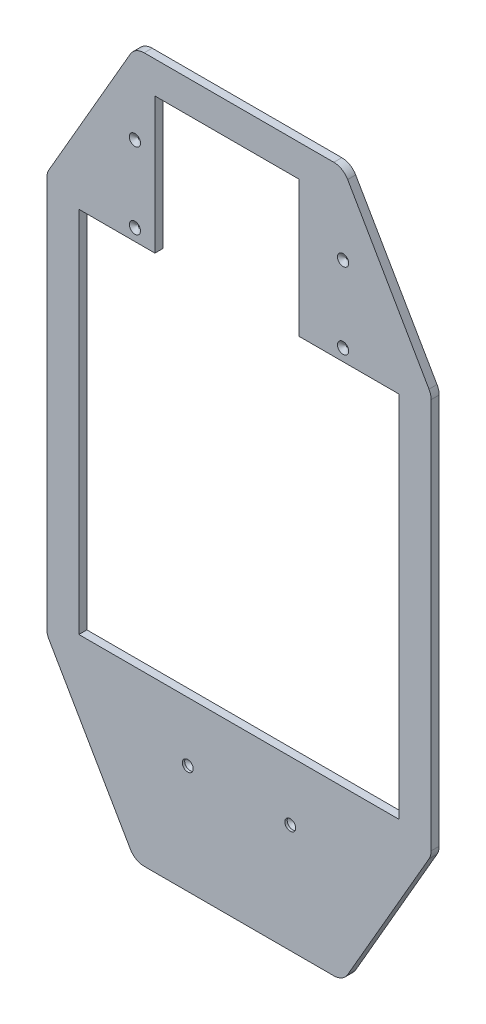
SolidWorks part; units mm, degrees
ref_plane "前视基准面" through (0, 0, 0) normal (0, 0, 1) x (1, 0, 0)
ref_plane "上视基准面" through (0, 0, 0) normal (0, 1, 0) x (1, 0, 0)
ref_plane "右视基准面" through (0, 0, 0) normal (1, 0, 0) x (0, 0, -1)
sketch "草图1" plane through (0, 0, 0) normal (0, 0, 1) x (1, 0, 0)
  line L0 (-98.6603, 121.6667) -> (-56.3212, 195)
  line L1 (47.661, 200) -> (-47.661, 200)
  line L2 (100, 116.6667) -> (100, -116.6667)
  line L3 (47.661, -200) -> (-47.661, -200)
  line L4 (-100, 116.6667) -> (-100, -116.6667)
  line L5 (-118.6603, 127.0257) -> (-67.8682, 215)
  line L6 (59.208, 220) -> (-59.208, 220)
  line L7 (0, 0) -> (0, 150) construction
  line L8 (0, 0) -> (100, 0) construction
  line L9 (98.6603, 121.6667) -> (56.3212, 195)
  line L10 (98.6603, -121.6667) -> (56.3212, -195)
  line L11 (-98.6603, -121.6667) -> (-56.3212, -195)
  line L12 (118.6603, 127.0257) -> (67.8682, 215)
  line L13 (120, 122.0257) -> (120, -122.0257)
  line L14 (118.6603, -127.0257) -> (67.8682, -215)
  line L15 (59.208, -220) -> (-59.208, -220)
  line L16 (-118.6603, -127.0257) -> (-67.8682, -215)
  line L17 (-120, 122.0257) -> (-120, -122.0257)
  line L18 (-120, -124.7051) -> (-64.9815, -220) construction
  line L19 (-120, 124.7051) -> (-120, -124.7051) construction
  line L20 (64.9815, -220) -> (-64.9815, -220) construction
  line L21 (120, -124.7051) -> (64.9815, -220) construction
  line L22 (120, 124.7051) -> (120, -124.7051) construction
  line L23 (-100, -119.3462) -> (-53.4345, -200) construction
  line L24 (53.4345, -200) -> (-53.4345, -200) construction
  line L25 (-100, 119.3462) -> (-100, -119.3462) construction
  line L26 (100, -119.3462) -> (53.4345, -200) construction
  line L27 (100, 119.3462) -> (100, -119.3462) construction
  line L28 (100, 119.3462) -> (53.4345, 200) construction
  line L29 (53.4345, 200) -> (-53.4345, 200) construction
  line L30 (-100, 119.3462) -> (-53.4345, 200) construction
  line L31 (120, 124.7051) -> (64.9815, 220) construction
  line L32 (64.9815, 220) -> (-64.9815, 220) construction
  line L33 (-120, 124.7051) -> (-64.9815, 220) construction
  arc A0 (-118.6603, -127.0257) -> (-120, -122.0257) centre (-110, -122.0257) cw
  arc A1 (-59.208, -220) -> (-67.8682, -215) centre (-59.208, -210) cw
  arc A2 (67.8682, -215) -> (59.208, -220) centre (59.208, -210) cw
  arc A3 (120, -122.0257) -> (118.6603, -127.0257) centre (110, -122.0257) cw
  arc A4 (-56.3212, -195) -> (-47.661, -200) centre (-47.661, -190) ccw
  arc A5 (-98.6603, -121.6667) -> (-100, -116.6667) centre (-90, -116.6667) cw
  arc A6 (56.3212, -195) -> (47.661, -200) centre (47.661, -190) cw
  arc A7 (98.6603, -121.6667) -> (100, -116.6667) centre (90, -116.6667) ccw
  arc A8 (56.3212, 195) -> (47.661, 200) centre (47.661, 190) ccw
  arc A9 (98.6603, 121.6667) -> (100, 116.6667) centre (90, 116.6667) cw
  arc A10 (-56.3212, 195) -> (-47.661, 200) centre (-47.661, 190) cw
  arc A11 (-98.6603, 121.6667) -> (-100, 116.6667) centre (-90, 116.6667) ccw
  arc A12 (118.6603, 127.0257) -> (120, 122.0257) centre (110, 122.0257) cw
  arc A13 (59.208, 220) -> (67.8682, 215) centre (59.208, 210) cw
  arc A14 (-67.8682, 215) -> (-59.208, 220) centre (-59.208, 210) cw
  arc A15 (-118.6603, 127.0257) -> (-120, 122.0257) centre (-110, 122.0257) ccw
  point P0 (0, 0)
  point P37 (-53.4345, -200)
  point P50 (53.4345, 200)
  dimension "D6" = 10
  dimension "D7" = 73.3333
  dimension "D1" = 400
  dimension "D2" = 200
  dimension "D3" = 100
  dimension "D4" = 200
  dimension "D5" = 20
  dimension "D8" = 30
  dimension "D9" = 73.3333
  dimension "D10" = 30
extrude "凸台-拉伸1" add sketch "草图1" along normal blind 30
sketch "草图2" plane through (0, 0, 30) normal (0, 0, 1) x (1, 0, 0)
  line L0 (-100, 130) -> (-70, 130)
  line L1 (-100, 116.6667) -> (-100, -116.6667) construction
  line L2 (-70, 130) -> (-70, 200)
  line L3 (47.661, 200) -> (-47.661, 200) construction
  line L4 (-70, 200) -> (-37.5, 200)
  line L5 (-37.5, 200) -> (-37.5, 115)
  line L6 (-37.5, 115) -> (-100, 115)
  line L7 (-100, 115) -> (-100, 130)
  line L8 (0, 0) -> (0, 200) construction
  dimension "D1" = 15
  dimension "D2" = 32.5
  dimension "D3" = 37.5
  dimension "D4" = 115
extrude "凸台-拉伸2" add sketch "草图2" against normal blind 40
mirror "镜向1" about plane through (0, 0, 0) normal (0, 1, 0) of "凸台-拉伸2"
mirror "镜向2" about plane through (0, 0, 0) normal (1, 0, 0) of "凸台-拉伸2", "镜向1"
sketch "草图3" plane through (0, 0, 0) normal (0, 0, -1) x (-1, 0, 0)
  line L0 (-100, 115) -> (100, 115)
  line L1 (100, 115) -> (100, -115)
  line L2 (100, -115) -> (-100, -115)
  line L3 (-100, -115) -> (-100, 115)
  line L8 (120, -122.0257) -> (120, 122.0257)
  line L10 (120, -122.0257) -> (120, 122.0257)
  line L12 (-120, 122.0257) -> (-120, -122.0257)
  line L13 (-118.6603, -127.0257) -> (-67.8682, -215)
  line L14 (118.6603, 127.0257) -> (67.8682, 215)
  line L20 (-120, 122.0257) -> (-120, -122.0257)
  line L21 (-118.6603, -127.0257) -> (-67.8682, -215)
  line L28 (118.6603, 127.0257) -> (67.8682, 215)
  line L29 (59.208, 220) -> (-59.208, 220)
  line L30 (59.208, 220) -> (-59.208, 220)
  line L31 (-67.8682, 215) -> (-118.6603, 127.0257)
  line L32 (-67.8682, 215) -> (-118.6603, 127.0257)
  line L34 (-59.208, -220) -> (59.208, -220)
  line L36 (-59.208, -220) -> (59.208, -220)
  line L38 (67.8682, -215) -> (118.6603, -127.0257)
  line L40 (67.8682, -215) -> (118.6603, -127.0257)
  arc A8 (118.6603, -127.0257) -> (120, -122.0257) centre (110, -122.0257) ccw
  arc A9 (118.6603, -127.0257) -> (120, -122.0257) centre (110, -122.0257) ccw
  arc A10 (120, 122.0257) -> (118.6603, 127.0257) centre (110, 122.0257) ccw
  arc A11 (120, 122.0257) -> (118.6603, 127.0257) centre (110, 122.0257) ccw
  arc A12 (-118.6603, 127.0257) -> (-120, 122.0257) centre (-110, 122.0257) ccw
  arc A13 (-120, -122.0257) -> (-118.6603, -127.0257) centre (-110, -122.0257) ccw
  arc A14 (67.8682, 215) -> (59.208, 220) centre (59.208, 210) ccw
  arc A15 (67.8682, 215) -> (59.208, 220) centre (59.208, 210) ccw
  arc A20 (-118.6603, 127.0257) -> (-120, 122.0257) centre (-110, 122.0257) ccw
  arc A21 (-120, -122.0257) -> (-118.6603, -127.0257) centre (-110, -122.0257) ccw
  arc A24 (-59.208, 220) -> (-67.8682, 215) centre (-59.208, 210) ccw
  arc A25 (-59.208, 220) -> (-67.8682, 215) centre (-59.208, 210) ccw
  arc A26 (-67.8682, -215) -> (-59.208, -220) centre (-59.208, -210) ccw
  arc A27 (-67.8682, -215) -> (-59.208, -220) centre (-59.208, -210) ccw
  arc A28 (59.208, -220) -> (67.8682, -215) centre (59.208, -210) ccw
  arc A29 (59.208, -220) -> (67.8682, -215) centre (59.208, -210) ccw
  dimension "D1" = 0
extrude "凸台-拉伸3" add sketch "草图3" along normal blind 20
sketch "草图5" plane through (0, 0, -20) normal (0, 0, -1) x (-1, 0, 0)
  line L0 (-67.8682, 215) -> (-67.8682, 310)
  line L1 (-67.8682, 310) -> (67.8682, 310)
  line L2 (67.8682, 310) -> (67.8682, 215)
  line L3 (59.208, 220) -> (-59.208, 220) construction
  line L4 (59.208, 220) -> (-59.208, 220)
  arc A0 (67.8682, 215) -> (59.208, 220) centre (59.208, 210) ccw construction
  arc A1 (-59.208, 220) -> (-67.8682, 215) centre (-59.208, 210) ccw construction
  arc A2 (67.8682, 215) -> (59.208, 220) centre (59.208, 210) ccw
  arc A3 (-59.208, 220) -> (-67.8682, 215) centre (-59.208, 210) ccw
  dimension "D1" = 90
extrude "凸台-拉伸11" add sketch "草图5" against normal blind 15 from offset 10
fillet "圆角3" radius 5 2 edges at (67.8682, 310, -2.5) (-67.8682, 310, -2.5)
sketch "草图6" plane through (0, 0, 0) normal (1, 0, 0) x (0, 0, -1)
  line L0 (-30, 220) -> (-5, 220) construction
  line L1 (17, 221) -> (-5, 221)
  line L2 (17, 221) -> (17, 199)
  line L3 (17, 199) -> (-5, 199)
  line L4 (-5, 221) -> (-5, 199)
  line L5 (17, 221) -> (-5, 199) construction
  line L6 (17, 199) -> (-5, 221) construction
  line L7 (-30, 127.0257) -> (-30, 215) construction
  point P0 (6, 210)
  dimension "D1" = 22
  dimension "D2" = 10
  dimension "D3" = 22
  dimension "D4" = 25
extrude "凸台-拉伸12" add sketch "草图6" along normal mid plane 450
sketch "草图10" plane through (0, 0, 30) normal (0, 0, 1) x (1, 0, 0)
  line L0 (-65, 122.5) -> (-65, 170) construction
  line L2 (-100, 115) -> (-37.5, 115) construction
  dimension "D1" = 65
  dimension "D2" = 7.5
  dimension "D3" = 47.5
hole_wizard "M8x1.0 螺纹孔1" positions "3D草图1" profile "草图11" tap size "M8x1.0" standard "GB"
sketch3d "3D草图1"
  point P0 (-65, 122.5, 30)
  point P3 (-65, 170, 30)
sketch "草图11" plane through (-65, 122.5, 30) normal (1, 0, 0) x (0, -1, 0)
  line L0 (0, 0) -> (0, 23.103)
  line L1 (0, 23.103) -> (3.5, 21)
  line L2 (3.5, 21) -> (3.5, 0)
  line L5 (3.5, 0) -> (0, 0)
  line L10 (0, 23.103) -> (-3.5, 21) construction
  line L11 (0, -6.35) -> (0, 107.95) construction
  dimension "螺纹孔钻头直径" = 7
  dimension "螺纹孔钻头深度" = 21
  dimension "导头角度" = 118
mirror "镜向7" about plane through (0, 0, 0) normal (1, 0, 0) of "M8x1.0 螺纹孔1"
sketch "草图14" plane through (0, 0, 0) normal (0, 0, 1) x (1, 0, 0)
  line L0 (-37.5, 200) -> (37.5, 200)
  line L1 (37.5, 200) -> (37.5, 199)
  line L2 (37.5, 199) -> (-37.5, 199)
  line L3 (-37.5, 199) -> (-37.5, 200)
extrude "切除-拉伸1" cut sketch "草图14" along normal blind 10
mirror "镜向8" about plane through (0, 0, 0) normal (0, 1, 0) of "切除-拉伸1", "凸台-拉伸12", "凸台-拉伸11"
sketch "草图15" plane through (0, 0, 5) normal (0, 0, 1) x (1, 0, 0)
  line L0 (225, 210) -> (191, 210) construction
  line L1 (194, 213) -> (188, 213)
  line L2 (194, 213) -> (194, 207)
  line L3 (194, 207) -> (188, 207)
  line L4 (188, 213) -> (188, 207)
  line L5 (194, 213) -> (188, 207) construction
  line L6 (194, 207) -> (188, 213) construction
  line L7 (225, 221) -> (225, 199) construction
  line L8 (191, 210) -> (176, 210) construction
  line L10 (179, 213) -> (173, 213)
  line L11 (179, 213) -> (179, 207)
  line L12 (179, 207) -> (173, 207)
  line L13 (173, 213) -> (173, 207)
  line L14 (179, 213) -> (173, 207) construction
  line L15 (179, 207) -> (173, 213) construction
  point P0 (191, 210)
  dimension "D1" = 6
  dimension "D2" = 6
  dimension "D3" = 34
  dimension "D4" = 15
  dimension "D5" = 6
  dimension "D6" = 6
sketch "草图16" plane through (0, 0, 5) normal (0, 0, 1) x (1, 0, 0)
  line L0 (135, 199) -> (135, -199)
  line L1 (225, 199) -> (77.1058, 199) construction
  line L2 (225, -199) -> (77.1058, -199) construction
  line L3 (135, -199) -> (77.1058, -199)
  line L4 (77.1058, -199) -> (118.6603, -127.0257)
  line L5 (120, -122.0257) -> (120, 122.0257) construction
  line L6 (120, -122.0257) -> (120, 122.0257)
  line L7 (118.6603, 127.0257) -> (67.8682, 215) construction
  line L8 (118.6603, 127.0257) -> (77.1058, 199)
  line L9 (135, 199) -> (77.1058, 199)
  line L10 (0, 0) -> (0, -200) construction
  line L11 (-37.5, -200) -> (37.5, -200) construction
  line L12 (-135, 199) -> (-77.1058, 199)
  line L13 (-118.6603, 127.0257) -> (-77.1058, 199)
  line L14 (-120, -122.0257) -> (-120, 122.0257)
  line L15 (-77.1058, -199) -> (-118.6603, -127.0257)
  line L16 (-135, -199) -> (-77.1058, -199)
  line L17 (-135, 199) -> (-135, -199)
  arc A0 (118.6603, -127.0257) -> (120, -122.0257) centre (110, -122.0257) ccw construction
  arc A1 (118.6603, -127.0257) -> (120, -122.0257) centre (110, -122.0257) ccw
  arc A2 (120, 122.0257) -> (118.6603, 127.0257) centre (110, 122.0257) ccw construction
  arc A3 (120, 122.0257) -> (118.6603, 127.0257) centre (110, 122.0257) ccw
  arc A4 (-120, 122.0257) -> (-118.6603, 127.0257) centre (-110, 122.0257) cw
  arc A5 (-118.6603, -127.0257) -> (-120, -122.0257) centre (-110, -122.0257) cw
  dimension "D1" = 15
extrude "凸台-拉伸13" add sketch "草图16" against normal blind 20 from offset 1
sketch "草图17" plane through (0, 0, 4) normal (0, 0, 1) x (1, 0, 0)
  line L0 (105.9734, 199) -> (135, 148.7244)
  line L1 (135, 199) -> (77.1058, 199) construction
  line L2 (135, -199) -> (135, 199) construction
  line L3 (135, 148.7244) -> (135, 199)
  line L4 (225, 199) -> (77.1058, 199) construction
  line L5 (135, 199) -> (105.9734, 199)
  line L6 (77.1058, 199) -> (118.6603, 127.0257) construction
  line L7 (118.6603, 127.0257) -> (67.8682, 215) construction
  line L8 (0, 0) -> (308.3014, 0) construction
  line L9 (135, -199) -> (105.9734, -199)
  line L10 (135, -148.7244) -> (135, -199)
  line L11 (105.9734, -199) -> (135, -148.7244)
  line L12 (0, 0) -> (0, -200) construction
  line L13 (-37.5, -200) -> (37.5, -200) construction
  line L14 (-105.9734, -199) -> (-135, -148.7244)
  line L15 (-135, -148.7244) -> (-135, -199)
  line L16 (-135, -199) -> (-105.9734, -199)
  line L17 (-135, 199) -> (-105.9734, 199)
  line L18 (-135, 148.7244) -> (-135, 199)
  line L19 (-105.9734, 199) -> (-135, 148.7244)
  dimension "D1" = 25
extrude "切除-拉伸3" cut sketch "草图17" against normal blind 20
fillet "圆角4" radius 5 8 edges at (105.9734, -199, -6) (135, -148.7244, -6) (135, 148.7244, -6) (105.9734, 199, -6) (-105.9734, 199, -6) (-135, 148.7244, -6) (-135, -148.7244, -6) (-105.9734, -199, -6)
sketch "草图18" plane through (225, 0, 0) normal (1, 0, 0) x (0, 0, -1)
  line L0 (-5, 199) -> (17, 199) construction
  line L1 (8, 203) -> (4, 203)
  line L2 (8, 203) -> (8, 195)
  line L3 (8, 195) -> (4, 195)
  line L4 (4, 203) -> (4, 195)
  line L5 (8, 203) -> (4, 195) construction
  line L6 (8, 195) -> (4, 203) construction
  point P0 (6, 199)
  dimension "D1" = 8
  dimension "D2" = 4
sketch "草图19" plane through (0, 0, 30) normal (0, 0, 1) x (1, 0, 0)
  line L3 (-93.849, 130) -> (-70, 130)
  line L4 (-70, 130) -> (-70, 171.3077)
  line L5 (-70, 171.3077) -> (-93.849, 130)
  line L6 (-93.849, 130) -> (-70, 130)
  line L7 (-70, 130) -> (-70, 171.3077)
  line L8 (-70, 171.3077) -> (-93.849, 130)
  line L9 (93.849, 130) -> (70, 171.3077)
  line L10 (70, 171.3077) -> (70, 130)
  line L11 (70, 130) -> (93.849, 130)
  line L12 (93.849, 130) -> (70, 171.3077)
  line L13 (70, 171.3077) -> (70, 130)
  line L14 (70, 130) -> (93.849, 130)
  line L15 (93.849, -130) -> (70, -130)
  line L16 (70, -130) -> (70, -171.3077)
  line L17 (70, -171.3077) -> (93.849, -130)
  line L18 (93.849, -130) -> (70, -130)
  line L19 (70, -130) -> (70, -171.3077)
  line L20 (70, -171.3077) -> (93.849, -130)
  line L21 (-93.849, -130) -> (-70, -171.3077)
  line L22 (-70, -171.3077) -> (-70, -130)
  line L23 (-70, -130) -> (-93.849, -130)
  line L24 (-93.849, -130) -> (-70, -171.3077)
  line L25 (-70, -171.3077) -> (-70, -130)
  line L26 (-70, -130) -> (-93.849, -130)
  dimension "D1" = 0
  dimension "D2" = 0
  dimension "D3" = 0
  dimension "D4" = 0
extrude "凸台-拉伸14" add sketch "草图19" against normal up to next
sketch "草图20" plane through (0, 0, -20) normal (0, 0, -1) x (-1, 0, 0)
  line L1 (-100, 115) -> (100, 115)
  line L2 (-100, 115) -> (-100, -115)
  line L3 (-100, -115) -> (100, -115)
  line L4 (100, 115) -> (100, -115)
  line L8 (120, -122.0257) -> (120, 122.0257)
  line L9 (118.6603, 127.0257) -> (67.8682, 215)
  line L10 (59.208, 220) -> (-59.208, 220)
  line L11 (-67.8682, 215) -> (-118.6603, 127.0257)
  line L12 (-120, 122.0257) -> (-120, -122.0257)
  line L13 (-118.6603, -127.0257) -> (-67.8682, -215)
  line L14 (-59.208, -220) -> (59.208, -220)
  line L15 (67.8682, -215) -> (118.6603, -127.0257)
  line L16 (120, -122.0257) -> (120, 122.0257)
  line L17 (118.6603, 127.0257) -> (67.8682, 215)
  line L18 (59.208, 220) -> (-59.208, 220)
  line L19 (-67.8682, 215) -> (-118.6603, 127.0257)
  line L20 (-120, 122.0257) -> (-120, -122.0257)
  line L21 (-118.6603, -127.0257) -> (-67.8682, -215)
  line L22 (-59.208, -220) -> (59.208, -220)
  line L23 (67.8682, -215) -> (118.6603, -127.0257)
  arc A8 (118.6603, -127.0257) -> (120, -122.0257) centre (110, -122.0257) ccw
  arc A9 (120, 122.0257) -> (118.6603, 127.0257) centre (110, 122.0257) ccw
  arc A10 (67.8682, 215) -> (59.208, 220) centre (59.208, 210) ccw
  arc A11 (-59.208, 220) -> (-67.8682, 215) centre (-59.208, 210) ccw
  arc A12 (-118.6603, 127.0257) -> (-120, 122.0257) centre (-110, 122.0257) ccw
  arc A13 (-120, -122.0257) -> (-118.6603, -127.0257) centre (-110, -122.0257) ccw
  arc A14 (-67.8682, -215) -> (-59.208, -220) centre (-59.208, -210) ccw
  arc A15 (59.208, -220) -> (67.8682, -215) centre (59.208, -210) ccw
  arc A16 (118.6603, -127.0257) -> (120, -122.0257) centre (110, -122.0257) ccw
  arc A17 (120, 122.0257) -> (118.6603, 127.0257) centre (110, 122.0257) ccw
  arc A18 (67.8682, 215) -> (59.208, 220) centre (59.208, 210) ccw
  arc A19 (-59.208, 220) -> (-67.8682, 215) centre (-59.208, 210) ccw
  arc A20 (-118.6603, 127.0257) -> (-120, 122.0257) centre (-110, 122.0257) ccw
  arc A21 (-120, -122.0257) -> (-118.6603, -127.0257) centre (-110, -122.0257) ccw
  arc A22 (-67.8682, -215) -> (-59.208, -220) centre (-59.208, -210) ccw
  arc A23 (59.208, -220) -> (67.8682, -215) centre (59.208, -210) ccw
  dimension "D1" = 0
extrude "凸台-拉伸15" add sketch "草图20" along normal blind 5
sketch "草图22" plane through (67.8682, 0, 0) normal (1, 0, 0) x (0, 0, -1)
  line L0 (10, 305) -> (10, 221) construction
  line L1 (10, 262) -> (0, 262)
  line L2 (10, 262) -> (10, 290)
  line L3 (10, 290) -> (0, 290)
  line L4 (0, 262) -> (0, 290)
  line L5 (-5, 310) -> (10, 310) construction
  line L6 (0, 264) -> (10, 266)
  line L7 (10, 272) -> (0, 274)
  line L8 (0, 276) -> (10, 276) construction
  line L9 (10, 280) -> (0, 278)
  line L10 (0, 288) -> (10, 286)
  dimension "D1" = 10
  dimension "D2" = 28
  dimension "D3" = 20
  dimension "D4" = 4
  dimension "D5" = 4
  dimension "D6" = 2
  dimension "D7" = 10
sketch "草图24" plane through (0, 0, 0) normal (0, 0, 1) x (1, 0, 0)
  line L4 (-37.5, -115) -> (-37.5, -200)
  line L7 (37.5, -115) -> (-37.5, -115)
  line L11 (37.5, -115) -> (-37.5, -115)
  line L16 (-37.5, -115) -> (-37.5, -200)
  line L19 (-37.5, -200) -> (37.5, -200)
  line L21 (-37.5, -200) -> (37.5, -200)
  line L22 (37.5, -200) -> (37.5, -115)
  line L23 (37.5, -200) -> (37.5, -115)
  dimension "D1" = 0
extrude "凸台-拉伸16" add sketch "草图24" along normal up to surface (30 mm away)
sketch "草图25" plane through (0, -115, 0) normal (0, 1, 0) x (1, 0, 0)
  line L0 (0, -30) -> (0, 22) construction
  line L1 (-100, -30) -> (100, -30) construction
  dimension "D1" = 52
hole_wizard "M8 螺纹孔1" positions "3D草图2" profile "草图26" tap size "M8" standard "GB"
sketch3d "3D草图2"
  point P0 (0, -115, -22)
sketch "草图26" plane through (0, -115, -22) normal (1, 0, 0) x (0, 0, 1)
  line L0 (0, 0) -> (0, 22.0429)
  line L1 (0, 22.0429) -> (3.4, 20)
  line L2 (3.4, 20) -> (3.4, 0)
  line L5 (3.4, 0) -> (0, 0)
  line L10 (0, 22.0429) -> (-3.4, 20) construction
  line L11 (0, -6.35) -> (0, 107.95) construction
  dimension "螺纹孔钻头直径" = 6.8
  dimension "螺纹孔钻头深度" = 20
  dimension "导头角度" = 118
sketch "草图27" plane through (0, 0, 30) normal (0, 0, 1) x (1, 0, 0)
  line L0 (-16, -115) -> (-16, -105)
  line L1 (-100, -115) -> (100, -115) construction
  line L2 (-16, -105) -> (16, -105)
  line L3 (0, -105) -> (0, -111) construction
  line L4 (12, -111) -> (-12, -111)
  line L5 (-12, -111) -> (-12, -115)
  line L6 (-12, -115) -> (-16, -115)
  line L7 (0, 0) -> (0, -105) construction
  line L8 (12, -115) -> (16, -115)
  line L9 (12, -111) -> (12, -115)
  line L10 (16, -115) -> (16, -105)
  dimension "D1" = 6
  dimension "D2" = 10
  dimension "D3" = 12
  dimension "D4" = 16
extrude "凸台-拉伸17" add sketch "草图27" against normal blind 5 from offset 12
pattern_linear "阵列(线性)2" count 2 spacing 26 along (0, 0, -1) of "凸台-拉伸17"
sketch "草图28" plane through (0, 0, 30) normal (0, 0, 1) x (1, 0, 0)
  line L0 (0, -115) -> (0, -152) construction
  line L1 (-100, -115) -> (100, -115) construction
  line L2 (0, -152) -> (-32, -152) construction
  line L3 (0, -152) -> (32, -152) construction
  dimension "D1" = 37
  dimension "D2" = 32
  dimension "D3" = 32
hole_wizard "M8 螺纹孔2" positions "3D草图3" profile "草图29" tap size "M8" standard "GB"
sketch3d "3D草图3"
  point P0 (-32, -152, 30)
  point P3 (32, -152, 30)
sketch "草图29" plane through (-32, -152, 30) normal (1, 0, 0) x (0, -1, 0)
  line L0 (0, 0) -> (0, 24.5429)
  line L1 (0, 24.5429) -> (3.4, 22.5)
  line L2 (3.4, 22.5) -> (3.4, 0)
  line L5 (3.4, 0) -> (0, 0)
  line L10 (0, 24.5429) -> (-3.4, 22.5) construction
  line L11 (0, -6.35) -> (0, 107.95) construction
  dimension "螺纹孔钻头直径" = 6.8
  dimension "螺纹孔钻头深度" = 22.5
  dimension "导头角度" = 118
sketch "草图30" plane through (-67.8682, 0, 0) normal (-1, 0, 0) x (0, 0, 1)
  line L0 (-10, -310) -> (-38.263, -300.579)
  line L1 (-57.2367, -297.5) -> (-125, -297.5)
  line L2 (-127.5, -295) -> (-127.5, -290)
  line L3 (-125, -287.5) -> (-10, -287.5)
  line L4 (-10, -221) -> (-10, -310) construction
  line L5 (-10, -287.5) -> (-10, -310)
  arc A0 (-38.263, -300.579) -> (-57.2367, -297.5) centre (-57.2367, -357.5) ccw
  arc A1 (-127.5, -290) -> (-125, -287.5) centre (-125, -290) cw
  arc A2 (-125, -297.5) -> (-127.5, -295) centre (-125, -295) cw
  point P10 (-47.5, -297.5)
  point P13 (-127.5, -287.5)
  point P16 (-127.5, -297.5)
  dimension "D5" = 60
  dimension "D6" = 2.5
  dimension "D1" = 12.5
  dimension "D2" = 10
  dimension "D3" = 117.5
  dimension "D4" = 80
sketch "草图32" plane through (0, 0, 30) normal (0, 0, 1) x (1, 0, 0)
  line L0 (-37.5, 200) -> (-52.5, 200)
  line L1 (-52.5, 200) -> (-52.5, 115)
  line L2 (-100, 115) -> (-37.5, 115) construction
  line L3 (-52.5, 115) -> (-37.5, 115)
  line L4 (-37.5, 115) -> (-37.5, 200)
  dimension "D1" = 15
extrude "切除-拉伸7" cut sketch "草图32" against normal up to surface (30 mm away)
sketch "草图33" plane through (0, 0, 0) normal (0, 0, 1) x (1, 0, 0)
  line L4 (37.5, 115) -> (37.5, 200)
  line L6 (-52.5, 200) -> (-52.5, 115)
  line L7 (-52.5, 115) -> (37.5, 115)
  line L10 (-52.5, 200) -> (-52.5, 115)
  line L11 (-52.5, 115) -> (37.5, 115)
  line L12 (37.5, 115) -> (37.5, 200)
  line L14 (37.5, 200) -> (-52.5, 200)
  line L15 (37.5, 200) -> (-52.5, 200)
  dimension "D1" = 0
extrude "切除-拉伸8" cut sketch "草图33" against normal blind 12
sketch "草图34" plane through (0, 0, 30) normal (0, 0, 1) x (1, 0, 0)
  line L0 (-100, -115) -> (100, -115) construction
  line L1 (-50, -115) -> (50, -115)
  line L2 (-50, -115) -> (-50, -174)
  line L3 (-50, -174) -> (50, -174)
  line L4 (50, -115) -> (50, -174)
  line L5 (0, -174) -> (0, -220) construction
  line L6 (59.208, -220) -> (-59.208, -220) construction
  dimension "D1" = 100
  dimension "D2" = 59
extrude "切除-拉伸9" cut sketch "草图34" against normal blind 9.25
sketch "草图35" plane through (0, 0, 30) normal (0, 0, 1) x (1, 0, 0)
  line L2 (-175.1264, 290.7759) -> (175.1264, 290.7759)
  line L3 (-175.1264, 290.7759) -> (-175.1264, -290.7759)
  line L4 (-175.1264, -290.7759) -> (175.1264, -290.7759)
  line L5 (175.1264, 290.7759) -> (175.1264, -290.7759)
  line L6 (-175.1264, 290.7759) -> (175.1264, -290.7759) construction
  line L7 (-175.1264, -290.7759) -> (175.1264, 290.7759) construction
  point P2 (0, 0)
extrude "切除-拉伸10" cut sketch "草图35" against normal offset from surface (21 mm away) 5
sketch "草图40" plane through (0, 0, -25) normal (0, 0, -1) x (-1, 0, 0)
  line L1 (-294.8809, 339.2041) -> (294.8809, 339.2041)
  line L2 (-294.8809, 339.2041) -> (-294.8809, -339.2041)
  line L3 (-294.8809, -339.2041) -> (294.8809, -339.2041)
  line L4 (294.8809, 339.2041) -> (294.8809, -339.2041)
  line L5 (-294.8809, 339.2041) -> (294.8809, -339.2041) construction
  line L6 (-294.8809, -339.2041) -> (294.8809, 339.2041) construction
  point P0 (0, 0)
sketch "草图42" plane through (0, 0, -25) normal (0, 0, -1) x (-1, 0, 0)
  line L8 (120, -122.0257) -> (120, 122.0257)
  line L9 (118.6603, 127.0257) -> (67.8682, 215)
  line L10 (59.208, 220) -> (-59.208, 220)
  line L11 (-67.8682, 215) -> (-118.6603, 127.0257)
  line L12 (-120, 122.0257) -> (-120, -122.0257)
  line L13 (-118.6603, -127.0257) -> (-67.8682, -215)
  line L14 (-59.208, -220) -> (59.208, -220)
  line L15 (67.8682, -215) -> (118.6603, -127.0257)
  line L16 (120, -122.0257) -> (120, 122.0257)
  line L17 (118.6603, 127.0257) -> (67.8682, 215)
  line L18 (59.208, 220) -> (-59.208, 220)
  line L19 (-67.8682, 215) -> (-118.6603, 127.0257)
  line L20 (-120, 122.0257) -> (-120, -122.0257)
  line L21 (-118.6603, -127.0257) -> (-67.8682, -215)
  line L22 (-59.208, -220) -> (59.208, -220)
  line L23 (67.8682, -215) -> (118.6603, -127.0257)
  arc A8 (118.6603, -127.0257) -> (120, -122.0257) centre (110, -122.0257) ccw
  arc A9 (120, 122.0257) -> (118.6603, 127.0257) centre (110, 122.0257) ccw
  arc A10 (67.8682, 215) -> (59.208, 220) centre (59.208, 210) ccw
  arc A11 (-59.208, 220) -> (-67.8682, 215) centre (-59.208, 210) ccw
  arc A12 (-118.6603, 127.0257) -> (-120, 122.0257) centre (-110, 122.0257) ccw
  arc A13 (-120, -122.0257) -> (-118.6603, -127.0257) centre (-110, -122.0257) ccw
  arc A14 (-67.8682, -215) -> (-59.208, -220) centre (-59.208, -210) ccw
  arc A15 (59.208, -220) -> (67.8682, -215) centre (59.208, -210) ccw
  arc A16 (118.6603, -127.0257) -> (120, -122.0257) centre (110, -122.0257) ccw
  arc A17 (120, 122.0257) -> (118.6603, 127.0257) centre (110, 122.0257) ccw
  arc A18 (67.8682, 215) -> (59.208, 220) centre (59.208, 210) ccw
  arc A19 (-59.208, 220) -> (-67.8682, 215) centre (-59.208, 210) ccw
  arc A20 (-118.6603, 127.0257) -> (-120, 122.0257) centre (-110, 122.0257) ccw
  arc A21 (-120, -122.0257) -> (-118.6603, -127.0257) centre (-110, -122.0257) ccw
  arc A22 (-67.8682, -215) -> (-59.208, -220) centre (-59.208, -210) ccw
  arc A23 (59.208, -220) -> (67.8682, -215) centre (59.208, -210) ccw
  dimension "D1" = 0
sketch "草图43" plane through (0, 0, -25) normal (0, 0, -1) x (-1, 0, 0)
  line L1 (-227.3114, 369.6277) -> (227.3114, 369.6277)
  line L2 (-227.3114, 369.6277) -> (-227.3114, -369.6277)
  line L3 (-227.3114, -369.6277) -> (227.3114, -369.6277)
  line L4 (227.3114, 369.6277) -> (227.3114, -369.6277)
  line L5 (-227.3114, 369.6277) -> (227.3114, -369.6277) construction
  line L6 (-227.3114, -369.6277) -> (227.3114, 369.6277) construction
  line L8 (120, -122.0257) -> (120, 122.0257)
  line L9 (118.6603, 127.0257) -> (67.8682, 215)
  line L10 (59.208, 220) -> (-59.208, 220)
  line L11 (-67.8682, 215) -> (-118.6603, 127.0257)
  line L12 (-120, 122.0257) -> (-120, -122.0257)
  line L13 (-118.6603, -127.0257) -> (-67.8682, -215)
  line L14 (-59.208, -220) -> (59.208, -220)
  line L15 (67.8682, -215) -> (118.6603, -127.0257)
  line L16 (120, -122.0257) -> (120, 122.0257)
  line L17 (118.6603, 127.0257) -> (67.8682, 215)
  line L18 (59.208, 220) -> (-59.208, 220)
  line L19 (-67.8682, 215) -> (-118.6603, 127.0257)
  line L20 (-120, 122.0257) -> (-120, -122.0257)
  line L21 (-118.6603, -127.0257) -> (-67.8682, -215)
  line L22 (-59.208, -220) -> (59.208, -220)
  line L23 (67.8682, -215) -> (118.6603, -127.0257)
  arc A8 (118.6603, -127.0257) -> (120, -122.0257) centre (110, -122.0257) ccw
  arc A9 (120, 122.0257) -> (118.6603, 127.0257) centre (110, 122.0257) ccw
  arc A10 (67.8682, 215) -> (59.208, 220) centre (59.208, 210) ccw
  arc A11 (-59.208, 220) -> (-67.8682, 215) centre (-59.208, 210) ccw
  arc A12 (-118.6603, 127.0257) -> (-120, 122.0257) centre (-110, 122.0257) ccw
  arc A13 (-120, -122.0257) -> (-118.6603, -127.0257) centre (-110, -122.0257) ccw
  arc A14 (-67.8682, -215) -> (-59.208, -220) centre (-59.208, -210) ccw
  arc A15 (59.208, -220) -> (67.8682, -215) centre (59.208, -210) ccw
  arc A16 (118.6603, -127.0257) -> (120, -122.0257) centre (110, -122.0257) ccw
  arc A17 (120, 122.0257) -> (118.6603, 127.0257) centre (110, 122.0257) ccw
  arc A18 (67.8682, 215) -> (59.208, 220) centre (59.208, 210) ccw
  arc A19 (-59.208, 220) -> (-67.8682, 215) centre (-59.208, 210) ccw
  arc A20 (-118.6603, 127.0257) -> (-120, 122.0257) centre (-110, 122.0257) ccw
  arc A21 (-120, -122.0257) -> (-118.6603, -127.0257) centre (-110, -122.0257) ccw
  arc A22 (-67.8682, -215) -> (-59.208, -220) centre (-59.208, -210) ccw
  arc A23 (59.208, -220) -> (67.8682, -215) centre (59.208, -210) ccw
  point P0 (0, 0)
  dimension "D1" = 0
sketch "草图45" plane through (0, 0, -25) normal (0, 0, -1) x (-1, 0, 0)
  line L1 (-183.5965, 287.6082) -> (183.5965, 287.6082)
  line L2 (-183.5965, 287.6082) -> (-183.5965, -287.6082)
  line L3 (-183.5965, -287.6082) -> (183.5965, -287.6082)
  line L4 (183.5965, 287.6082) -> (183.5965, -287.6082)
  line L5 (-183.5965, 287.6082) -> (183.5965, -287.6082) construction
  line L6 (-183.5965, -287.6082) -> (183.5965, 287.6082) construction
  point P0 (0, 0)
sketch "草图52" plane through (0, 0, 9) normal (0, 0, 1) x (1, 0, 0)
  line L8 (59.208, 220) -> (-59.208, 220)
  line L9 (-67.8682, 215) -> (-118.6603, 127.0257)
  line L10 (-120, 122.0257) -> (-120, -122.0257)
  line L11 (-118.6603, -127.0257) -> (-67.8682, -215)
  line L12 (-59.208, -220) -> (59.208, -220)
  line L13 (67.8682, -215) -> (118.6603, -127.0257)
  line L14 (120, -122.0257) -> (120, 122.0257)
  line L15 (118.6603, 127.0257) -> (67.8682, 215)
  line L16 (59.208, 220) -> (-59.208, 220)
  line L17 (-67.8682, 215) -> (-118.6603, 127.0257)
  line L18 (-120, 122.0257) -> (-120, -122.0257)
  line L19 (-118.6603, -127.0257) -> (-67.8682, -215)
  line L20 (-59.208, -220) -> (59.208, -220)
  line L21 (67.8682, -215) -> (118.6603, -127.0257)
  line L22 (120, -122.0257) -> (120, 122.0257)
  line L23 (118.6603, 127.0257) -> (67.8682, 215)
  arc A8 (-59.208, 220) -> (-67.8682, 215) centre (-59.208, 210) ccw
  arc A9 (-118.6603, 127.0257) -> (-120, 122.0257) centre (-110, 122.0257) ccw
  arc A10 (-120, -122.0257) -> (-118.6603, -127.0257) centre (-110, -122.0257) ccw
  arc A11 (-67.8682, -215) -> (-59.208, -220) centre (-59.208, -210) ccw
  arc A12 (59.208, -220) -> (67.8682, -215) centre (59.208, -210) ccw
  arc A13 (118.6603, -127.0257) -> (120, -122.0257) centre (110, -122.0257) ccw
  arc A14 (120, 122.0257) -> (118.6603, 127.0257) centre (110, 122.0257) ccw
  arc A15 (67.8682, 215) -> (59.208, 220) centre (59.208, 210) ccw
  arc A16 (-59.208, 220) -> (-67.8682, 215) centre (-59.208, 210) ccw
  arc A17 (-118.6603, 127.0257) -> (-120, 122.0257) centre (-110, 122.0257) ccw
  arc A18 (-120, -122.0257) -> (-118.6603, -127.0257) centre (-110, -122.0257) ccw
  arc A19 (-67.8682, -215) -> (-59.208, -220) centre (-59.208, -210) ccw
  arc A20 (59.208, -220) -> (67.8682, -215) centre (59.208, -210) ccw
  arc A21 (118.6603, -127.0257) -> (120, -122.0257) centre (110, -122.0257) ccw
  arc A22 (120, 122.0257) -> (118.6603, 127.0257) centre (110, 122.0257) ccw
  arc A23 (67.8682, 215) -> (59.208, 220) centre (59.208, 210) ccw
  dimension "D1" = 0
sketch "草图53" plane through (0, 0, 9) normal (0, 0, 1) x (1, 0, 0)
  line L1 (-373.4967, 367.981) -> (373.4967, 367.981)
  line L2 (-373.4967, 367.981) -> (-373.4967, -367.981)
  line L3 (-373.4967, -367.981) -> (373.4967, -367.981)
  line L4 (373.4967, 367.981) -> (373.4967, -367.981)
  line L5 (-373.4967, 367.981) -> (373.4967, -367.981) construction
  line L6 (-373.4967, -367.981) -> (373.4967, 367.981) construction
  point P0 (0, 0)
extrude "切除-拉伸26" cut sketch "草图53" against normal blind 110 from offset 5
sketch "草图54" plane through (0, 0, 9) normal (0, 0, 1) x (1, 0, 0)
  line L8 (59.208, 220) -> (-59.208, 220)
  line L9 (-67.8682, 215) -> (-118.6603, 127.0257)
  line L10 (-120, 122.0257) -> (-120, -122.0257)
  line L11 (-118.6603, -127.0257) -> (-67.8682, -215)
  line L12 (-59.208, -220) -> (59.208, -220)
  line L13 (67.8682, -215) -> (118.6603, -127.0257)
  line L14 (120, -122.0257) -> (120, 122.0257)
  line L15 (118.6603, 127.0257) -> (67.8682, 215)
  line L16 (59.208, 220) -> (-59.208, 220)
  line L17 (-67.8682, 215) -> (-118.6603, 127.0257)
  line L18 (-120, 122.0257) -> (-120, -122.0257)
  line L19 (-118.6603, -127.0257) -> (-67.8682, -215)
  line L20 (-59.208, -220) -> (59.208, -220)
  line L21 (67.8682, -215) -> (118.6603, -127.0257)
  line L22 (120, -122.0257) -> (120, 122.0257)
  line L23 (118.6603, 127.0257) -> (67.8682, 215)
  arc A8 (-59.208, 220) -> (-67.8682, 215) centre (-59.208, 210) ccw
  arc A9 (-118.6603, 127.0257) -> (-120, 122.0257) centre (-110, 122.0257) ccw
  arc A10 (-120, -122.0257) -> (-118.6603, -127.0257) centre (-110, -122.0257) ccw
  arc A11 (-67.8682, -215) -> (-59.208, -220) centre (-59.208, -210) ccw
  arc A12 (59.208, -220) -> (67.8682, -215) centre (59.208, -210) ccw
  arc A13 (118.6603, -127.0257) -> (120, -122.0257) centre (110, -122.0257) ccw
  arc A14 (120, 122.0257) -> (118.6603, 127.0257) centre (110, 122.0257) ccw
  arc A15 (67.8682, 215) -> (59.208, 220) centre (59.208, 210) ccw
  arc A16 (-59.208, 220) -> (-67.8682, 215) centre (-59.208, 210) ccw
  arc A17 (-118.6603, 127.0257) -> (-120, 122.0257) centre (-110, 122.0257) ccw
  arc A18 (-120, -122.0257) -> (-118.6603, -127.0257) centre (-110, -122.0257) ccw
  arc A19 (-67.8682, -215) -> (-59.208, -220) centre (-59.208, -210) ccw
  arc A20 (59.208, -220) -> (67.8682, -215) centre (59.208, -210) ccw
  arc A21 (118.6603, -127.0257) -> (120, -122.0257) centre (110, -122.0257) ccw
  arc A22 (120, 122.0257) -> (118.6603, 127.0257) centre (110, 122.0257) ccw
  arc A23 (67.8682, 215) -> (59.208, 220) centre (59.208, 210) ccw
  dimension "D1" = 0
extrude "切除-拉伸27" cut sketch "草图54" against normal blind 110 flip side to cut
equation "\"F\"=542"
